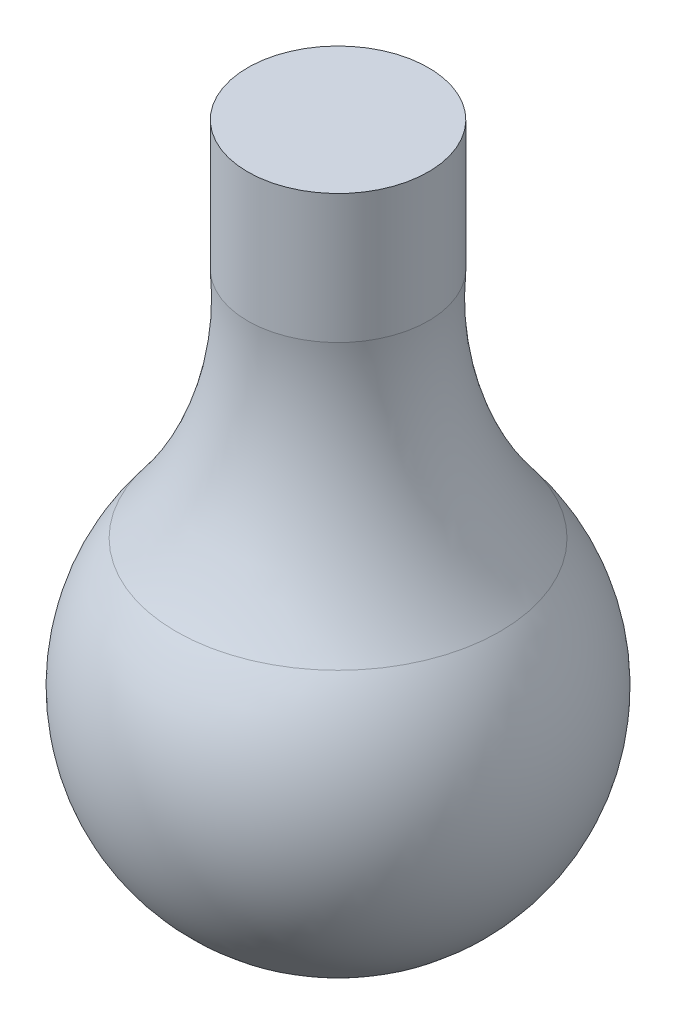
SolidWorks part; units mm, degrees
ref_plane "Front Plane" through (0, 0, 0) normal (0, 0, 1) x (1, 0, 0)
ref_plane "Top Plane" through (0, 0, 0) normal (0, 1, 0) x (1, 0, 0)
ref_plane "Right Plane" through (0, 0, 0) normal (1, 0, 0) x (0, 0, -1)
sketch "Sketch1" plane through (0, 0, 0) normal (0, 1, 0) x (1, 0, 0)
  circle A0 centre (0, 0) radius 3.5
  dimension "D1" = 7
extrude "Boss-Extrude1" add sketch "Sketch1" along normal blind 5
sketch "Sketch2" plane through (0, 0, 0) normal (0, 0, 1) x (1, 0, 0)
  line L0 (0, 5.7909) -> (0, -28.4666) construction
  line L1 (0, -22) -> (0, 0)
  line L2 (3.5, 0) -> (0, 0)
  arc A0 (0, -22) -> (6.2721, -9.034) centre (0, -14) ccw
  arc A1 (3.5, 0) -> (6.2721, -9.034) centre (16.4642, -0.9643) ccw
  dimension "D1" = 8
  dimension "D2" = 13
  dimension "D3" = 22
revolve "Revolve1" add sketch "Sketch2" angle 360 about L0
